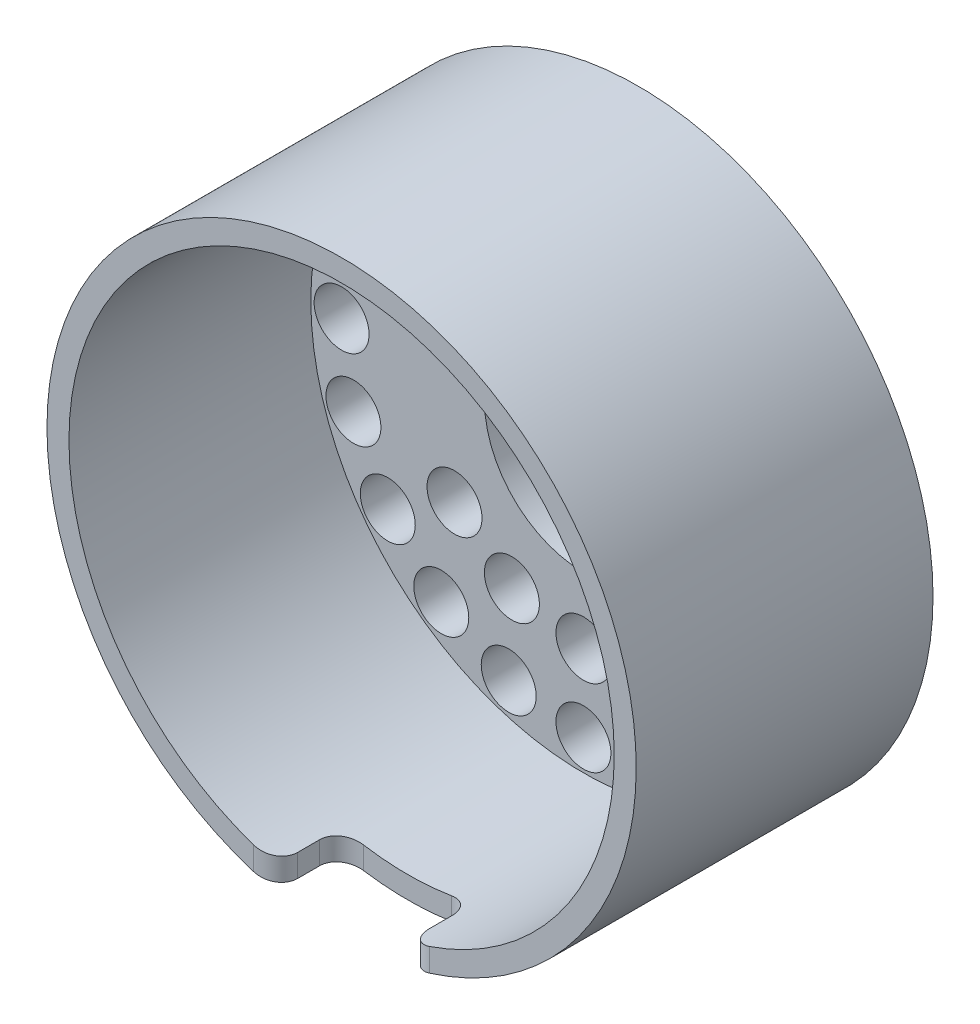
SolidWorks part; units mm, degrees
ref_plane "Front Plane" through (0, 0, 0) normal (0, 0, 1) x (1, 0, 0)
ref_plane "Top Plane" through (0, 0, 0) normal (0, 1, 0) x (1, 0, 0)
ref_plane "Right Plane" through (0, 0, 0) normal (1, 0, 0) x (0, 0, -1)
sketch "Sketch1" plane through (0, 0, 0) normal (0, 0, 1) x (1, 0, 0)
  circle A0 centre (0, 0) radius 34.036
  circle A2 centre (0, 0) radius 11.43
  dimension "D1" = 68.072
  dimension "D2" = 22.86
extrude "Boss-Extrude1" add sketch "Sketch1" along normal blind 6.35
sketch "Sketch2" plane through (0, 0, 0) normal (0, 0, -1) x (-1, 0, 0)
  line L0 (0, 55) -> (0, -55) construction
  line L1 (14.097, 3.3655) -> (20.828, 3.3655)
  line L2 (14.097, 3.3655) -> (14.097, -3.3655)
  line L3 (14.097, -3.3655) -> (20.828, -3.3655)
  line L4 (20.828, 3.3655) -> (20.828, -3.3655)
  line L5 (14.097, 3.3655) -> (20.828, -3.3655) construction
  line L6 (14.097, -3.3655) -> (20.828, 3.3655) construction
  line L7 (-14.097, -3.3655) -> (-20.828, 3.3655) construction
  line L8 (-14.097, 3.3655) -> (-20.828, -3.3655) construction
  line L9 (-20.828, 3.3655) -> (-20.828, -3.3655)
  line L10 (-14.097, -3.3655) -> (-20.828, -3.3655)
  line L11 (-14.097, 3.3655) -> (-14.097, -3.3655)
  line L12 (-14.097, 3.3655) -> (-20.828, 3.3655)
  point P0 (17.4625, 0)
  point P13 (-17.4625, 0)
  dimension "D1" = 6.731
  dimension "D2" = 34.925
extrude "Boss-Extrude2" add sketch "Sketch2" along normal blind 10.16
sketch "Sketch3" plane through (0, 0, 6.35) normal (0, 0, 1) x (1, 0, 0)
  circle A0 centre (0, 0) radius 31.496
  circle A1 centre (0, 0) radius 34.036
  circle A2 centre (0, 0) radius 34.036
  dimension "D2" = 2.54
  dimension "D1" = 0
extrude "Boss-Extrude3" add sketch "Sketch3" along normal blind 27.94
fillet "Fillet1" radius 1.27 8 edges at (-17.4625, -3.3655, -10.16) (-14.097, 0, -10.16) (-17.4625, 3.3655, -10.16) (-20.828, 0, -10.16) (17.4625, -3.3655, -10.16) (20.828, 0, -10.16) (17.4625, 3.3655, -10.16) (14.097, 0, -10.16)
fillet "Fillet2" radius 2.54 1 edges at (11.43, 0, 0)
sketch "Sketch4" plane through (0, 0, 0) normal (0, 1, 0) x (1, 0, 0)
  line L0 (-7.62, -34.29) -> (-7.62, -26.67)
  line L1 (-7.62, -26.67) -> (7.62, -26.67)
  line L2 (7.62, -26.67) -> (7.62, -34.29)
  line L3 (7.62, -34.29) -> (-7.62, -34.29)
  line L4 (-34.036, -34.29) -> (34.036, -34.29) construction
  point P9 (0, -26.67)
  dimension "D1" = 7.62
  dimension "D2" = 15.24
extrude "Cut-Extrude1" cut sketch "Sketch4" against normal up to surface (33.172 mm away)
fillet "Fillet3" radius 2.54 4 edges at (7.62, -31.8662, 26.67) (-7.62, -31.8662, 26.67) (7.62, -31.8662, 34.29) (-7.62, -31.8662, 34.29)
sketch "Sketch5" plane through (0, 0, 0) normal (0, 0, -1) x (-1, 0, 0)
  circle A1 centre (0, 19.05) radius 3.175
  point P4 (0, 0)
  point P6 (0, 19.2023)
  point P7 (5.0669, 26.6754)
  dimension "D2" = 6.35
  dimension "D3" = 19.05
extrude "Cut-Extrude2" cut sketch "Sketch5" against normal up to surface (6.35 mm away)
pattern_circular "CirPattern1" count 14 over 360 about axis through (0, 0, 0) along (0, 0, 1) of "Cut-Extrude2"
sketch "Sketch6" plane through (0, 0, 0) normal (0, 0, -1) x (-1, 0, 0)
  circle A0 centre (0, 27.94) radius 3.175
  circle A1 centre (0, 19.05) radius 3.175 construction
  point P4 (0, 0)
  dimension "D1" = 8.89
extrude "Cut-Extrude3" cut sketch "Sketch6" against normal up to surface (6.35 mm away) contours A0
pattern_circular "CirPattern2" count 20 over 360 about axis through (0, 0, 0) along (0, 0, 1) of "Cut-Extrude3"
